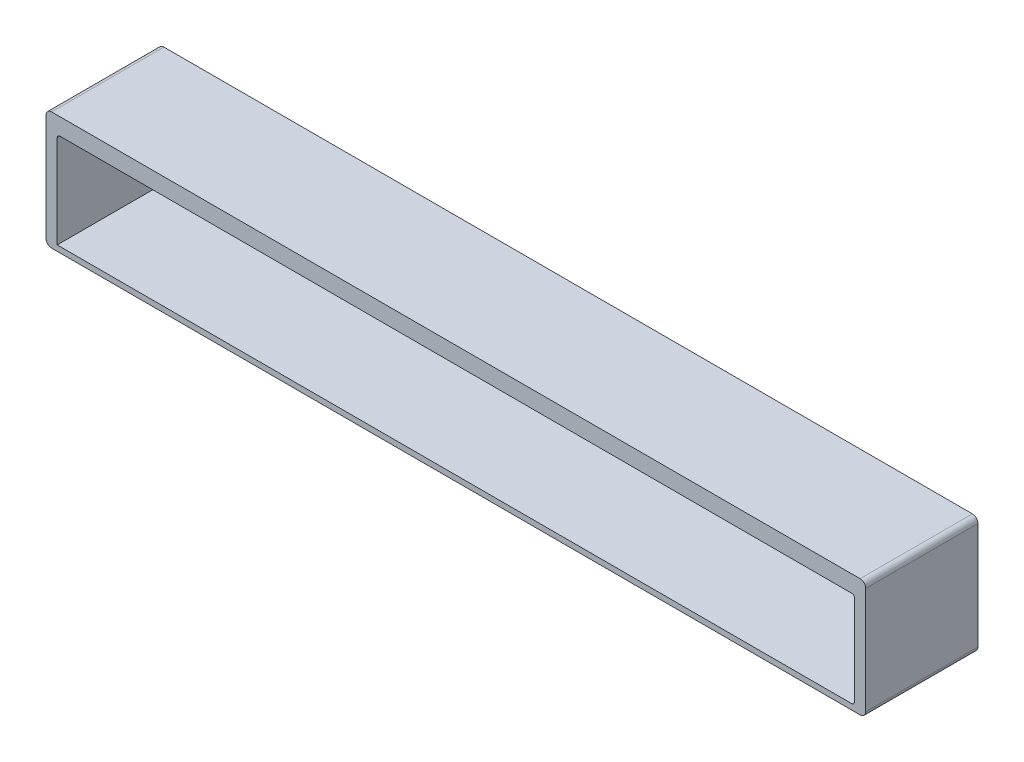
SolidWorks part; units mm, degrees
ref_plane "Front Plane" through (0, 0, 0) normal (0, 0, 1) x (1, 0, 0)
ref_plane "Top Plane" through (0, 0, 0) normal (0, 1, 0) x (1, 0, 0)
ref_plane "Right Plane" through (0, 0, 0) normal (1, 0, 0) x (0, 0, -1)
ref_plane "Ebene3" through (-90.21, -6.1077, 22.5) normal (1, 0, 0) x (0, 0, -1)
ref_plane "Ebene4" through (-91.21, -7.1077, -99.5) normal (0, 1, 0) x (-1, 0, 0)
sketch "Skizze17" plane through (0, 0, -12.6188) normal (0, 0, 1) x (1, 0, 0)
  line L0 (-23.7526, -7.6077) -> (-85.6673, -7.6077) construction
  line L1 (-88.21, -7.6077) -> (-21.21, -7.6077)
  line L2 (-88.21, -7.6077) -> (-88.21, -6.1077)
  line L3 (-88.21, -6.1077) -> (-21.21, -6.1077)
  line L4 (-21.21, -7.6077) -> (-21.21, -6.1077)
  line L5 (-90.21, -6.1077) -> (-19.21, -6.1077) construction
  line L6 (-90.21, -8.6077) -> (-90.21, -7.6077) construction
  line L8 (-19.21, -8.6077) -> (-19.21, -10.6077) construction
  dimension "D1" = 2
  dimension "D3" = 2
extrude "Linear austragen1" add sketch "Skizze17" against normal up to surface (86.3812 mm away)
sketch "Skizze19" plane through (-21.21, 0, 0) normal (1, 0, 0) x (0, 0, -1)
  line L1 (99, -7.6077) -> (99, -6.1077) construction
  line L2 (99, -6.1077) -> (100, -6.1077)
  line L3 (99, -6.1077) -> (99, -16.6171)
  line L4 (99, -16.6171) -> (100, -16.6171)
  line L5 (100, -6.1077) -> (100, -16.6171)
  dimension "D1" = 1
extrude "Linear austragen2" add sketch "Skizze19" against normal up to surface (67 mm away)
sketch "Skizze23" plane through (-90.21, 0, 0) normal (-1, 0, 0) x (0, 0, 1)
  line L0 (-99, -7.6077) -> (-12.6188, -7.6077) construction
  line L1 (-100, -6.1077) -> (-12.6188, -6.1077)
  line L2 (-100, -6.1077) -> (-100, -7.6077)
  line L3 (-100, -7.6077) -> (-12.6188, -7.6077)
  line L4 (-12.6188, -6.1077) -> (-12.6188, -7.6077)
  line L5 (-100, -16.6171) -> (-100, -6.1077) construction
  line L6 (-100, -6.1077) -> (-12.6188, -6.1077) construction
  line L7 (-12.6188, -6.1077) -> (-12.6188, -7.6077) construction
extrude "Linear austragen3" add sketch "Skizze23" against normal up to surface (2 mm away)
sketch "Skizze24" plane through (-19.21, 0, 0) normal (1, 0, 0) x (0, 0, -1)
  line L1 (12.6188, -7.6077) -> (100, -7.6077)
  line L2 (12.6188, -7.6077) -> (12.6188, -6.1077)
  line L3 (12.6188, -6.1077) -> (100, -6.1077)
  line L4 (100, -7.6077) -> (100, -6.1077)
  line L7 (12.6188, -7.6077) -> (12.6188, -6.1077) construction
  line L8 (99, -7.6077) -> (12.6188, -7.6077) construction
  line L9 (100, -6.1077) -> (12.6188, -6.1077) construction
  line L10 (100, -16.6171) -> (100, -6.1077) construction
extrude "Linear austragen4" add sketch "Skizze24" against normal up to surface (2 mm away)
sketch "Skizze25" plane through (0, -16.6171, 0) normal (0, -1, 0) x (1, 0, 0)
  line L0 (-19.21, -12.6188) -> (-19.21, -100) construction
  line L1 (-21.21, -100) -> (-19.21, -100)
  line L2 (-21.21, -100) -> (-21.21, -99)
  line L3 (-21.21, -99) -> (-19.21, -99)
  line L4 (-19.21, -100) -> (-19.21, -99)
  line L5 (-88.21, -100) -> (-21.21, -100) construction
  line L6 (-21.21, -99) -> (-23.7526, -99) construction
extrude "Linear austragen5" add sketch "Skizze25" against normal up to surface (9.0094 mm away)
sketch "Skizze26" plane through (0, -16.6171, 0) normal (0, -1, 0) x (1, 0, 0)
  line L1 (-88.21, -100) -> (-90.21, -100)
  line L2 (-88.21, -100) -> (-88.21, -99)
  line L3 (-88.21, -99) -> (-90.21, -99)
  line L4 (-90.21, -100) -> (-90.21, -99)
  line L5 (-88.21, -100) -> (-90.21, -100) construction
  line L7 (-88.21, -99) -> (-19.21, -99) construction
  line L8 (-90.21, -100) -> (-90.21, -12.6188) construction
  line L9 (-88.21, -99) -> (-88.21, -100) construction
sketch "Skizze27" plane through (0, -6.1077, 0) normal (0, 1, 0) x (1, 0, 0)
  line L0 (-19.21, 12.6188) -> (-90.21, 12.6188) construction
  line L1 (-90.21, 12.6188) -> (-91.21, 12.6188)
  line L2 (-90.21, 12.6188) -> (-90.21, 100)
  line L3 (-90.21, 100) -> (-91.21, 100)
  line L4 (-91.21, 12.6188) -> (-91.21, 100)
  line L5 (-90.21, 100) -> (-19.21, 100) construction
  line L6 (-90.21, 12.6188) -> (-90.21, 100) construction
  dimension "D1" = 1
extrude "Linear austragen7" add sketch "Skizze27" against normal up to surface (10.5094 mm away)
sketch "Skizze29" plane through (0, -6.1077, 0) normal (0, 1, 0) x (1, 0, 0)
  line L1 (-19.21, 12.6188) -> (-18.21, 12.6188)
  line L2 (-19.21, 12.6188) -> (-19.21, 100)
  line L3 (-19.21, 100) -> (-18.21, 100)
  line L4 (-18.21, 12.6188) -> (-18.21, 100)
  line L6 (-19.21, 12.6188) -> (-91.21, 12.6188) construction
  line L8 (-91.21, 100) -> (-19.21, 100) construction
  line L9 (-19.21, 100) -> (-19.21, 12.6188) construction
  dimension "D1" = 1
extrude "Linear austragen8" add sketch "Skizze29" against normal up to surface (10.5094 mm away)
sketch "Skizze36" plane through (0, 0, -12.6188) normal (0, 0, 1) x (1, 0, 0)
  line L1 (-18.21, -16.1171) -> (-91.21, -16.1171)
  line L2 (-18.21, -16.1171) -> (-18.21, -16.6171)
  line L3 (-18.21, -16.6171) -> (-91.21, -16.6171)
  line L4 (-91.21, -16.1171) -> (-91.21, -16.6171)
  line L5 (-91.21, -16.6171) -> (-91.21, -6.1077) construction
  line L6 (-18.21, -16.6171) -> (-18.21, -6.1077) construction
  line L7 (-88.21, -16.6171) -> (-19.21, -16.6171) construction
  dimension "D1" = 0.5
extrude "Linear austragen9" add sketch "Skizze36" against normal up to surface (87.3812 mm away)
sketch "Skizze37" plane through (-91.21, 0, 0) normal (-1, 0, 0) x (0, 0, 1)
  line L0 (-100, -16.6171) -> (-100, -6.1077) construction
  line L1 (-22.6188, -40.6709) -> (-110, -40.6709)
  line L2 (-22.6188, -40.6709) -> (-22.6188, 5.4889)
  line L3 (-22.6188, 5.4889) -> (-110, 5.4889)
  line L4 (-110, -40.6709) -> (-110, 5.4889)
  line L7 (-12.6188, -16.6171) -> (-12.6188, -6.1077) construction
  dimension "D1" = 10
  dimension "D2" = 10
extrude "Schnitt-Linear austragen1" cut sketch "Skizze37" against normal through all
fillet "Verrundung1" radius 0.5 4 edges at (-18.21, -6.1077, -17.6188) (-18.21, -16.6171, -17.6188) (-91.21, -16.6171, -17.6188) (-91.21, -6.1077, -17.6188)
fillet "Verrundung2" radius 0.25 3 edges at (-19.21, -16.1171, -17.6188)
